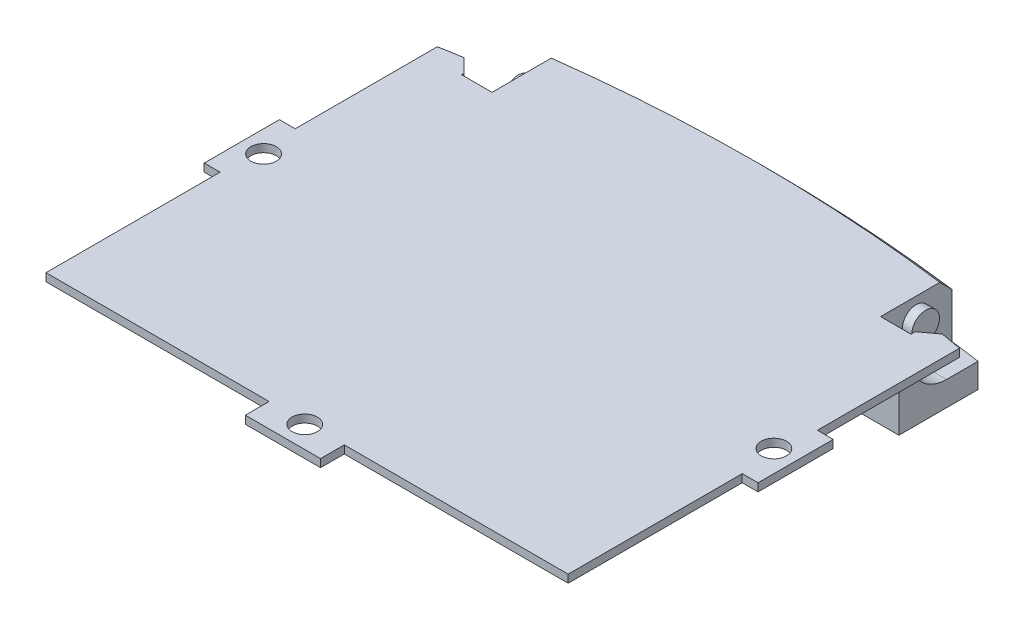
SolidWorks part; units mm, degrees
ref_plane "Front Plane" through (0, 0, 0) normal (0, 0, 1) x (1, 0, 0)
ref_plane "Top Plane" through (0, 0, 0) normal (0, 1, 0) x (1, 0, 0)
ref_plane "Right Plane" through (0, 0, 0) normal (1, 0, 0) x (0, 0, -1)
sketch "Sketch1" plane through (0, 0, 0) normal (0, 1, 0) x (1, 0, 0)
  line L1 (33, -50) -> (-33, -50)
  line L2 (33, -50) -> (33, 50)
  line L3 (33, 50) -> (-33, 50)
  line L4 (-33, -50) -> (-33, 50)
  line L5 (33, -50) -> (-33, 50) construction
  line L6 (33, 50) -> (-33, -50) construction
  point P0 (0, 0)
  dimension "D1" = 66
  dimension "D2" = 100
extrude "Boss-Extrude1" add sketch "Sketch1" along normal blind 1
sketch "Sketch2" plane through (0, 0, 0) normal (0, -1, 0) x (1, 0, 0)
  line L0 (-28.5, -0.3154) -> (-28.5, -6.3841)
  line L1 (28.5, -6.3841) -> (28.5, -0.3154)
  line L2 (-74.6992, 13.0677) -> (-74.6992, 50)
  line L3 (-74.6992, 50) -> (74.6992, 50)
  line L4 (74.6992, 50) -> (74.6992, 13.0677)
  line L5 (-33, 50) -> (33, 50) construction
  arc A0 (28.5, -0.3154) -> (74.6992, 13.0677) centre (0, 184.5) ccw construction
  arc A1 (-74.6992, 13.0677) -> (-28.5, -0.3154) centre (0, 184.5) ccw construction
  arc A2 (28.5, -6.3841) -> (89.6448, 13.5825) centre (0, 184.5) ccw construction
  arc A3 (-89.6448, 13.5825) -> (-28.5, -6.3841) centre (0, 184.5) ccw construction
  arc A4 (28.5, -0.3154) -> (74.6992, 13.0677) centre (0, 184.5) ccw
  arc A5 (-74.6992, 13.0677) -> (-28.5, -0.3154) centre (0, 184.5) ccw
  arc A6 (28.5, -6.3841) -> (89.6448, 13.5825) centre (0, 184.5) ccw construction
  arc A7 (-89.6448, 13.5825) -> (-28.5, -6.3841) centre (0, 184.5) ccw construction
  arc A8 (-28.5, -6.3841) -> (28.5, -6.3841) centre (0, 184.5) ccw
extrude "Cut-Extrude1" cut sketch "Sketch2" against normal through all flip side to cut
sketch "Sketch3" plane through (0, 0, 0) normal (0, -1, 0) x (1, 0, 0)
  line L0 (-28.5, -0.3154) -> (-28.5, -6.3841) construction
  line L1 (-28.5, -0.3154) -> (-28.5, -6.3841)
  line L2 (-28.4, -0.2297) -> (-28.4, -6.399)
  line L4 (-28.4, -0.2297) -> (-28.4, -6.3841) construction
  line L5 (-33, 0.5364) -> (-33, 0.4348)
  line L6 (0, 0) -> (0, -8.5) construction
  line L7 (33, 0.5364) -> (33, 0.4348)
  line L8 (28.4, -0.2297) -> (28.4, -6.399)
  line L9 (28.5, -0.3154) -> (28.5, -6.3841)
  arc A0 (-33, 0.4348) -> (-28.5, -0.3154) centre (0, 184.5) ccw construction
  arc A1 (-33, 0.4348) -> (-28.5, -0.3154) centre (0, 184.5) ccw
  arc A2 (-33, 0.5364) -> (-28.4, -0.2297) centre (0, 184.5) ccw
  arc A3 (-32.9824, 0.5332) -> (-28.4, -0.2297) centre (0, 184.5) ccw construction
  arc A4 (-28.5, -6.3841) -> (28.5, -6.3841) centre (0, 184.5) ccw construction
  arc A5 (-28.5, -6.3841) -> (-28.4, -6.399) centre (0, 184.5) ccw
  arc A6 (28.5, -6.3841) -> (28.4, -6.399) centre (0, 184.5) cw
  arc A7 (33, 0.5364) -> (28.4, -0.2297) centre (0, 184.5) cw
  arc A8 (33, 0.4348) -> (28.5, -0.3154) centre (0, 184.5) cw
  dimension "D1" = 0.1
extrude "Cut-Extrude2" cut sketch "Sketch3" against normal through all
sketch "Sketch4" plane through (0, 0, 0) normal (0, -1, 0) x (-1, 0, 0)
  line L0 (33, -50) -> (-33, -50) construction
  line L1 (35, -28) -> (-35, -28)
  line L2 (35, -28) -> (35, -18.5)
  line L3 (35, -18.5) -> (-35, -18.5)
  line L4 (-35, -28) -> (-35, -18.5)
  line L5 (-4.7, -53) -> (4.8, -53)
  line L6 (-4.7, -53) -> (-4.7, -50)
  line L7 (-4.7, -50) -> (4.8, -50)
  line L8 (4.8, -53) -> (4.8, -50)
  circle A0 centre (32.25, -23.25) radius 1.6 construction
  circle A1 centre (32.25, -23.25) radius 1.6 construction
  circle A2 centre (-32.25, -23.25) radius 1.6 construction
  circle A3 centre (-32.25, -23.25) radius 1.6 construction
  circle A4 centre (0.05, -50.25) radius 1.6 construction
  circle A5 centre (0.05, -50.25) radius 1.6 construction
extrude "Boss-Extrude2" add sketch "Sketch4" against normal up to surface (1 mm away)
sketch "Sketch5" plane through (0, 0, 0) normal (0, -1, 0) x (1, 0, 0)
  circle A0 centre (32.25, 23.25) radius 1.6 construction
  circle A1 centre (-32.25, 23.25) radius 1.6 construction
  circle A2 centre (-0.05, 50.25) radius 1.6 construction
  circle A3 centre (32.25, 23.25) radius 1.6
  circle A4 centre (-32.25, 23.25) radius 1.6
  circle A5 centre (-0.05, 50.25) radius 1.6
extrude "Cut-Extrude3" cut sketch "Sketch5" against normal through all
sketch "Sketch6" plane through (0, 0, 0) normal (0, -1, 0) x (1, 0, 0)
  line L1 (-28.4, -6.399) -> (-28.4, -0.2297) construction
  line L2 (28.4, -0.2297) -> (28.4, -6.399) construction
  line L3 (28.4, -4.8824) -> (28.4, -6.399)
  line L4 (-28.4, -4.8824) -> (-28.4, -6.399)
  arc A0 (-28.4, -6.399) -> (28.4, -6.399) centre (0, 184.5) ccw construction
  arc A1 (-28.4, -6.399) -> (28.4, -6.399) centre (0, 184.5) ccw
  arc A2 (-28.4, -4.8824) -> (28.4, -4.8824) centre (0, 184.5) ccw
  arc A3 (-28.1793, -4.9154) -> (28.1793, -4.9154) centre (0, 184.5) ccw construction
  dimension "D1" = 1.5
extrude "Boss-Extrude3" add sketch "Sketch6" along normal blind 9.3
sketch "Sketch7" plane through (0, 0, 0) normal (0, -1, 0) x (1, 0, 0)
  line L0 (-9.05, -7.5) -> (9.05, -7.5)
  line L1 (-9, 29.7) -> (9, 29.7) construction
  line L2 (-9, 29.7) -> (-9, -7.45) construction
  line L3 (-9, -7.45) -> (9, -7.45) construction
  line L4 (9, 29.7) -> (9, -7.45) construction
  line L5 (9.05, 29.75) -> (9.05, -7.5)
  line L6 (-9.05, 29.75) -> (9.05, 29.75)
  line L7 (-9.05, 29.75) -> (-9.05, -7.5)
  arc A1 (-28.4, -6.399) -> (28.4, -6.399) centre (0, 184.5) ccw construction
  point P5 (0, 29.7)
  point P12 (0, -8.5)
  dimension "D1" = 18
  dimension "D2" = 37.15
  dimension "D4" = 1
  dimension "D3" = 0.05
extrude "Cut-Extrude4" cut sketch "Sketch7" along normal blind 2
sketch "Sketch8" plane through (0, 0, 0) normal (0, -1, 0) x (1, 0, 0)
  line L0 (0, 0) -> (0, -8.5) construction
  line L1 (-9.05, -7.5) -> (-9.8, -7.5)
  line L2 (-9.05, -7.5) -> (-9.05, 27.5)
  line L3 (-9.05, 27.5) -> (-9.8, 27.5)
  line L4 (-9.8, -7.5) -> (-9.8, 27.5)
  line L5 (9.8, -7.5) -> (9.8, 27.5)
  line L6 (9.05, 27.5) -> (9.8, 27.5)
  line L7 (9.05, -7.5) -> (9.05, 27.5)
  line L8 (9.05, -7.5) -> (9.8, -7.5)
  line L9 (-9.05, 29.75) -> (9.05, 29.75) construction
  line L10 (-7, 29.75) -> (7, 29.75)
  line L11 (-7, 29.75) -> (-7, 30.5)
  line L12 (-7, 30.5) -> (7, 30.5)
  line L13 (7, 29.75) -> (7, 30.5)
  arc A0 (-28.4, -6.399) -> (28.4, -6.399) centre (0, 184.5) ccw construction
  point P21 (0, 30.5)
  dimension "D1" = 35
  dimension "D2" = 0.75
  dimension "D3" = 14
extrude "Boss-Extrude4" add sketch "Sketch8" along normal blind 1.9
sketch "Sketch9" plane through (0, -1.9, 0) normal (0, -1, 0) x (1, 0, 0)
  line L0 (-9.8, 27.5) -> (-9.8, -6.7491) construction
  line L1 (-9.8, -2.5) -> (-7.05, -2.5)
  line L2 (-9.8, -2.5) -> (-9.8, -7.5)
  line L3 (-9.8, -7.5) -> (-7.05, -7.5)
  line L4 (-7.05, -2.5) -> (-7.05, -7.5)
  line L5 (-9.05, -6.786) -> (-9.05, 27.5) construction
  line L6 (-9.05, -7.5) -> (9.05, -7.5) construction
  line L7 (0, 0) -> (0, 13.2401) construction
  line L8 (7.05, -2.5) -> (7.05, -7.5)
  line L9 (9.8, -7.5) -> (7.05, -7.5)
  line L10 (9.8, -2.5) -> (9.8, -7.5)
  line L11 (9.8, -2.5) -> (7.05, -2.5)
  dimension "D1" = 5
  dimension "D2" = 2
extrude "Boss-Extrude5" add sketch "Sketch9" along normal blind 1
sketch "Sketch10" plane through (0, 0, 0) normal (0, -1, 0) x (1, 0, 0)
  line L1 (-9.8, 17.5) -> (9.8, 17.5)
  line L2 (-9.8, 17.5) -> (-9.8, 3.2509)
  line L3 (-9.8, 3.2509) -> (9.8, 3.2509)
  line L4 (9.8, 17.5) -> (9.8, 3.2509)
  line L5 (-9.8, 27.5) -> (-9.8, -6.7491) construction
  line L6 (-9.05, 27.5) -> (-9.8, 27.5) construction
  line L7 (9.8, -6.7491) -> (9.8, 27.5) construction
  dimension "D1" = 10
  dimension "D2" = 10
extrude "Cut-Extrude5" cut sketch "Sketch10" along normal up to surface (1.9 mm away)
sketch "Sketch11" plane through (0, -1.9, 0) normal (0, -1, 0) x (1, 0, 0)
  line L0 (-7, 29.75) -> (7, 29.75) construction
  line L1 (-7, 30.5) -> (7, 30.5)
  line L2 (-7, 30.5) -> (-7, 29.25)
  line L3 (-7, 29.25) -> (7, 29.25)
  line L4 (7, 30.5) -> (7, 29.25)
  dimension "D1" = 0.5
extrude "Boss-Extrude6" add sketch "Sketch11" along normal blind 0.6
sketch "Sketch12" plane through (0, 0, 0) normal (0, 0, 1) x (1, 0, 0)
  line L0 (-2.93, -3.1) -> (2.93, -3.1) construction
  line L1 (-2.93, -1.35) -> (2.93, -1.35)
  line L2 (-2.93, -4.85) -> (2.93, -4.85)
  arc A0 (-2.93, -1.35) -> (-2.93, -4.85) centre (-2.93, -3.1) ccw
  arc A1 (2.93, -4.85) -> (2.93, -1.35) centre (2.93, -3.1) ccw
  arc A2 (2.93, -4.38) -> (2.93, -1.82) centre (2.93, -3.1) ccw construction
  point P2 (0, -3.1)
  point P16 (4.21, -3.1)
  dimension "D1" = 3.5
extrude "Cut-Extrude6" cut sketch "Sketch12" against normal through all
sketch "Sketch14" plane through (0, -9.3, 0) normal (0, -1, 0) x (1, 0, 0)
  line L0 (-28.4, -6.399) -> (-28.4, -0.2297)
  line L1 (-28.4, -0.2297) -> (-27.4, -0.2297)
  line L2 (-27.4, -0.2297) -> (-27.4, -6.5451)
  line L3 (0, 0) -> (0, -8.5) construction
  arc A0 (-28.4, -6.399) -> (28.4, -6.399) centre (0, 184.5) ccw construction
  arc A1 (-28.4, -6.399) -> (-27.4, -6.5451) centre (0, 184.5) ccw
  dimension "D1" = 1
extrude "Boss-Extrude7" add sketch "Sketch14" against normal up to surface (9.3 mm away)
mirror "Mirror1" about plane through (0, 0, 0) normal (1, 0, 0) of "Boss-Extrude7"
sketch "Sketch15" plane through (28.4, 0, 0) normal (1, 0, 0) x (0, 0, -1)
  line L3 (6.4287, 1.3) -> (6.4287, -1.7)
  line L4 (-1.5713, 1.3) -> (-1.5713, -1.7)
  line L5 (6.4287, 1.3) -> (-1.5713, 1.3)
  line L6 (-18.5, 1) -> (-0.5364, 1) construction
  line L8 (8.5, -1.35) -> (8.5, 1) construction
  line L9 (0.2297, 1) -> (6.399, 1) construction
  arc A1 (-1.5713, -1.7) -> (6.4287, -1.7) centre (2.4287, -1.7) ccw
  circle A3 centre (2.4287, -1.7) radius 2
  dimension "D4" = 4
  dimension "D5" = 4
  dimension "D1" = 2.7
  dimension "D2" = 6.0713
  dimension "D3" = 0.3
sketch "Sketch16" plane through (0, -9.3, 0) normal (0, -1, 0) x (1, 0, 0)
  line L0 (28.4, -6.399) -> (28.4, 3.601)
  line L3 (28.4, 3.601) -> (22.4, 3.601)
  line L4 (22.4, 3.601) -> (22.4, -7.1957)
  arc A1 (22.4, -7.1957) -> (28.4, -6.399) centre (0, 184.5) ccw
  arc A2 (-28.4, -6.399) -> (28.4, -6.399) centre (0, 184.5) ccw construction
  dimension "D1" = 6
  dimension "D2" = 10
extrude "Boss-Extrude8" add sketch "Sketch16" against normal up to surface (9.3 mm away)
sketch "Sketch17" plane through (28.4, 0, 0) normal (1, 0, 0) x (0, 0, -1)
  line L0 (2.4287, -6.2) -> (8.5, -6.2)
  line L1 (8.5, -9.3) -> (8.5, -4.85) construction
  line L2 (8.5, -6.2) -> (8.5, 1)
  line L3 (8.5, 1) -> (-2.0713, 1)
  line L4 (-2.0713, 1) -> (-2.0713, -1.7)
  line L5 (-18.5, 1) -> (-0.5364, 1) construction
  arc A1 (-2.0713, -1.7) -> (2.4287, -6.2) centre (2.4287, -1.7) ccw
  dimension "D1" = 4.5
extrude "Cut-Extrude7" cut sketch "Sketch17" against normal blind 3.85
sketch "Sketch18" plane through (24.55, 0, 0) normal (1, 0, 0) x (0, 0, -1)
  circle A0 centre (2.4287, -1.7) radius 1.75
  dimension "D1" = 3.5
extrude "Boss-Extrude9" add sketch "Sketch18" along normal blind 1.2
mirror "Mirror5" about plane through (0, 0, 0) normal (1, 0, 0) of "Boss-Extrude9", "Boss-Extrude8", "Cut-Extrude7"
chamfer "Chamfer1" distance 2 angle 45 2 edges at (28.4, 0.5, -0.2297) (-28.4, 0.5, -0.2297)
chamfer "Chamfer2" distance 1.5 angle 45 1 edges at (0, 1, -8.5)
chamfer "Chamfer3" distance 2 angle 45 2 edges at (-16.1088, 0, -6.3213) (16.1088, 0, -6.3213)
